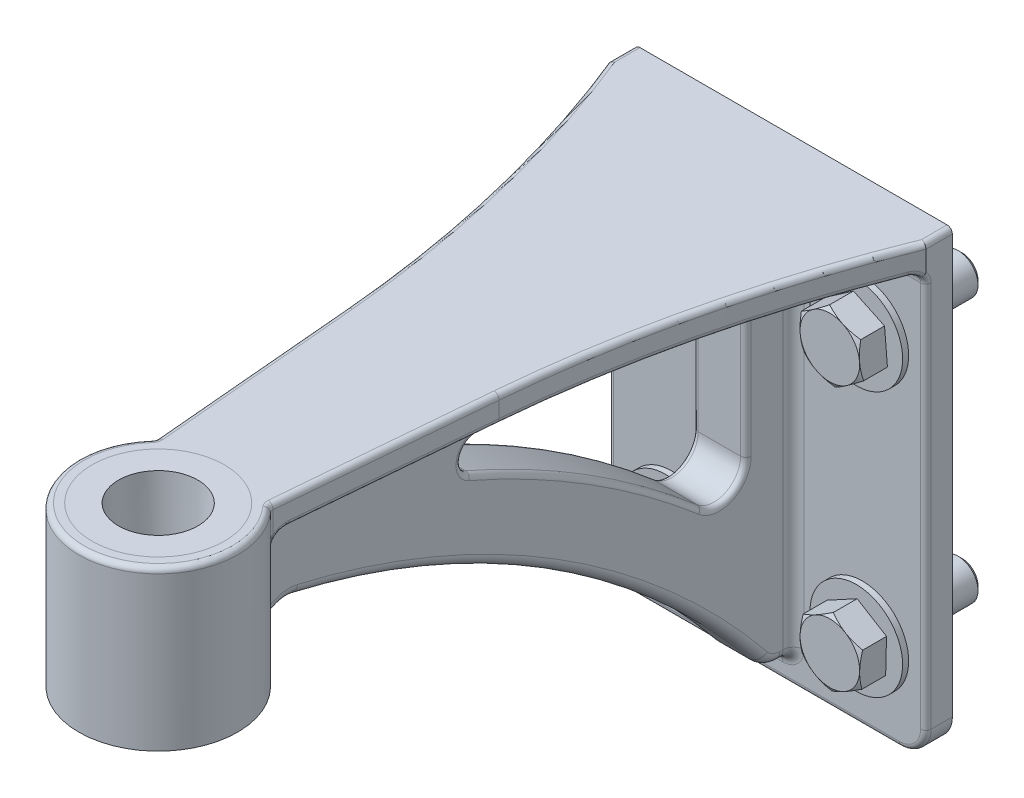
SolidWorks part; units mm, degrees
ref_plane "Front Plane" through (0, 0, 0) normal (0, 0, 1) x (1, 0, 0)
ref_plane "Top Plane" through (0, 0, 0) normal (0, 1, 0) x (1, 0, 0)
ref_plane "Right Plane" through (0, 0, 0) normal (1, 0, 0) x (0, 0, -1)
imported_body "3.3-1-1-solid1"
imported_body "3.3-2-1-solid1"
imported_body "3.3-2-2-solid1"
imported_body "3.3-3-2-solid1"
imported_body "3.3-3-3-solid1"
imported_body "3.3-3-4-solid1"
imported_body "3.3-3-5-solid1"
imported_body "3.3-2-3-solid1"
imported_body "3.3-2-4-solid1"
combine bodies "Combine1" operation type add bodies to combine 101 102 108 105 104 103 107 109 106
